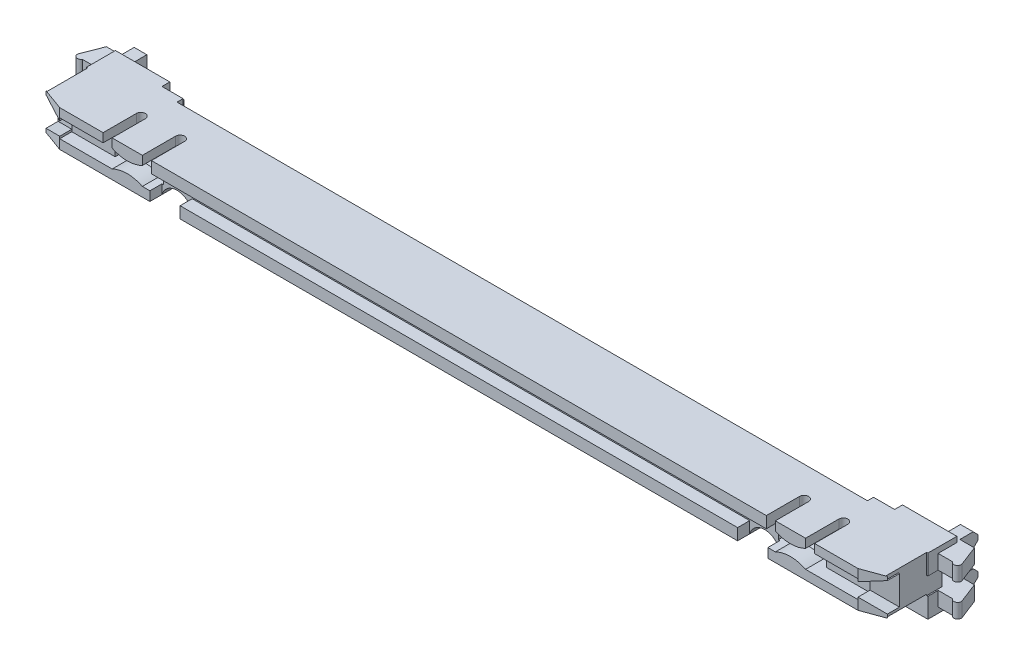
SolidWorks part; units mm, degrees
ref_plane "前视基准面" through (0, 0, 0) normal (0, 0, 1) x (1, 0, 0)
ref_plane "上视基准面" through (0, 0, 0) normal (0, 1, 0) x (1, 0, 0)
ref_plane "右视基准面" through (0, 0, 0) normal (1, 0, 0) x (0, 0, -1)
sketch "草图1" plane through (0, 0, 0) normal (0, 0, 1) x (1, 0, 0)
  line L0 (-43.2098, -1.25) -> (43.2098, -1.25)
  line L1 (-69.65, 4.75) -> (69.65, 4.75)
  line L2 (-69.65, 4.75) -> (-69.65, -4.75)
  line L3 (-69.65, -4.75) -> (-50.15, -4.75)
  line L4 (69.65, 4.75) -> (69.65, -4.75)
  line L5 (-69.65, 4.75) -> (69.65, -4.75) construction
  line L6 (-69.65, -4.75) -> (69.65, 4.75) construction
  line L7 (0, 0) -> (0, 14.6466) construction
  line L8 (-45.85, -2.8255) -> (-46.4498, -3.9371)
  line L9 (-48.65, -1.75) -> (-48.65, -2.75) construction
  line L10 (50.15, -4.75) -> (69.65, -4.75)
  line L11 (45.85, -2.8255) -> (46.4498, -3.9371)
  line L12 (-48.65, -2) -> (-48.65, -2.5) construction
  line L13 (-47.4, -2) -> (-47.4, -2.5)
  line L14 (-49.9, -2) -> (-49.9, -2.5)
  line L15 (48.65, -2) -> (48.65, -2.5) construction
  line L16 (47.4, -2) -> (47.4, -2.5)
  line L17 (49.9, -2) -> (49.9, -2.5)
  arc A0 (50.15, -4.75) -> (46.4498, -3.9371) centre (48.65, -2.75) cw
  arc A1 (-50.15, -4.75) -> (-46.4498, -3.9371) centre (-48.65, -2.75) ccw
  arc A2 (-47.4, -2) -> (-49.9, -2) centre (-48.65, -2) ccw
  arc A3 (-49.9, -2.5) -> (-47.4, -2.5) centre (-48.65, -2.5) ccw
  arc A4 (47.4, -2) -> (49.9, -2) centre (48.65, -2) cw
  arc A5 (49.9, -2.5) -> (47.4, -2.5) centre (48.65, -2.5) cw
  arc A6 (45.85, -2.8255) -> (43.2098, -1.25) centre (43.2098, -4.25) ccw
  arc A7 (-45.85, -2.8255) -> (-43.2098, -1.25) centre (-43.2098, -4.25) cw
  point P0 (0, 0)
  point P12 (-48.65, -2.25)
  point P19 (-48.65, -2.25)
  point P24 (-48.65, -0.75)
  point P25 (-48.65, -3.75)
  point P31 (48.65, -2.25)
  point P36 (45, -1.25)
  point P39 (-45, -1.25)
  dimension "D5" = 2.5
  dimension "D8" = 21
  dimension "D11" = 3
  dimension "D9" = 7.5
  dimension "D1" = 139.3
  dimension "D2" = 9.5
  dimension "D3" = 2.5
  dimension "D4" = 3
  dimension "D6" = 5.5
  dimension "D7" = 24.65
  dimension "D10" = 6
extrude "凸台-拉伸1" add sketch "草图1" along normal blind 8.5
sketch "草图3" plane through (0, 0, 8.5) normal (0, 0, 1) x (1, 0, 0)
  line L0 (69.65, -4.75) -> (69.65, 4.75) construction
  line L1 (-69.65, 4.75) -> (69.65, 4.75)
  line L2 (-69.65, 4.75) -> (-69.65, 2.85)
  line L3 (-69.65, 2.85) -> (69.65, 2.85)
  line L4 (69.65, 4.75) -> (69.65, 2.85)
  line L5 (-69.65, 4.75) -> (-69.65, -4.75) construction
  line L6 (-69.65, 0.65) -> (-51.15, 0.65)
  line L7 (-69.65, 0.65) -> (-69.65, -1.25)
  line L8 (-69.65, -1.25) -> (-51.15, -1.25)
  line L9 (69.65, 0.65) -> (69.65, -1.25)
  line L10 (-43.2098, -1.25) -> (43.2098, -1.25) construction
  line L11 (-51.15, 0.65) -> (-51.15, -1.25)
  line L12 (-46.15, 0.65) -> (-46.15, -1.25)
  line L13 (-46.15, 0.65) -> (46.15, 0.65)
  line L14 (-46.15, -1.25) -> (46.15, -1.25)
  line L15 (46.15, 0.65) -> (46.15, -1.25)
  line L16 (51.15, 0.65) -> (51.15, -1.25)
  line L17 (51.15, 0.65) -> (69.65, 0.65)
  line L18 (51.15, -1.25) -> (69.65, -1.25)
  dimension "D1" = 1.9
  dimension "D2" = 1.9
  dimension "D3" = 18.5
  dimension "D4" = 5
  dimension "D5" = 5
  dimension "D6" = 18.5
extrude "凸台-拉伸2" add sketch "草图3" along normal blind 2
sketch "草图4" plane through (0, 0, 0) normal (0, 0, -1) x (-1, 0, 0)
  line L0 (-69.65, 4.75) -> (69.65, 4.75) construction
  line L1 (0, 0) -> (0, -11.2324) construction
  line L2 (-16.325, 3.25) -> (-0.5, 3.25)
  line L3 (-33.15, 3.25) -> (-17.325, 3.25)
  line L4 (-33.15, 3.25) -> (-33.15, 0.25)
  line L5 (-50.9, 3.29) -> (-67.35, 3.29)
  line L6 (-50.9, -2) -> (-50.9, -3.25)
  line L8 (-67.35, -3.25) -> (-67.35, 3.29)
  line L9 (-50.9, 2.25) -> (-50.9, 3.29)
  line L10 (-48.9, 2.25) -> (-50.9, 2.25)
  line L11 (-50.9, -3.25) -> (-67.35, -3.25)
  line L12 (-48.9, 3.25) -> (-48.9, 2.25)
  line L13 (-34.15, 0.25) -> (-48.65, 0.25)
  line L14 (-34.15, 3.25) -> (-34.15, 0.25)
  line L15 (-34.15, 3.25) -> (-48.9, 3.25)
  line L17 (-33.15, 0.25) -> (-17.325, 0.25)
  line L18 (-17.325, 3.25) -> (-17.325, 0.25)
  line L19 (-16.325, 3.25) -> (-16.325, 0.25)
  line L20 (-16.325, 0.25) -> (-0.5, 0.25)
  line L21 (-0.5, 3.25) -> (-0.5, 0.25)
  line L22 (0.5, 3.25) -> (16.325, 3.25)
  line L23 (0.5, 3.25) -> (0.5, 0.25)
  line L24 (0.5, 0.25) -> (16.325, 0.25)
  line L25 (16.325, 3.25) -> (16.325, 0.25)
  line L26 (17.325, 3.25) -> (33.15, 3.25)
  line L27 (17.325, 3.25) -> (17.325, 0.25)
  line L28 (17.325, 0.25) -> (33.15, 0.25)
  line L29 (33.15, 3.25) -> (33.15, 0.25)
  line L32 (34.15, 3.25) -> (48.9, 3.25)
  line L33 (34.15, 3.25) -> (34.15, 0.25)
  line L34 (34.15, 0.25) -> (48.65, 0.25)
  line L35 (48.9, 3.25) -> (48.9, 2.25)
  line L37 (43.2098, -1.25) -> (-43.2098, -1.25) construction
  line L38 (69.65, 4.75) -> (69.65, -4.75) construction
  line L39 (50.9, -3.25) -> (67.35, -3.25)
  line L40 (48.9, 2.25) -> (50.9, 2.25)
  line L41 (50.9, 2.25) -> (50.9, 3.29)
  line L42 (67.35, -3.25) -> (67.35, 3.29)
  line L45 (69.65, -4.75) -> (50.15, -4.75) construction
  line L46 (50.9, -2) -> (50.9, -3.25)
  line L54 (50.9, 3.29) -> (67.35, 3.29)
  arc A0 (50.9, -2) -> (48.65, 0.25) centre (48.65, -2) ccw
  arc A2 (-48.65, 0.25) -> (-50.9, -2) centre (-48.65, -2) ccw
  dimension "D3" = 1.5
  dimension "D5" = 2
  dimension "D4" = 1.5
  dimension "D15" = 4.5
  dimension "D2" = 35.5
  dimension "D6" = 1
  dimension "D7" = 2.5
  dimension "D8" = 2.3
  dimension "D9" = 1.46
  dimension "D10" = 1.5
  dimension "D13" = 1
  dimension "D14" = 1
  dimension "D12" = 4
extrude "切除-拉伸1" cut sketch "草图4" against normal blind 1.4
ref_plane "基准面1" through (0, 3.85, 0) normal (0, 1, 0) x (1, 0, 0)
sketch "草图5" plane through (0, 3.85, 0) normal (0, 1, 0) x (1, 0, 0)
  line L0 (67.35, 0) -> (69.65, 0)
  line L1 (50.15, 0) -> (69.65, 0) construction
  line L2 (69.65, 0) -> (69.65, -0.8)
  line L3 (69.65, -8.5) -> (69.65, 0) construction
  line L4 (69.65, -0.8) -> (72.0453, -0.8)
  line L5 (73.1243, -0.2829) -> (71.85, 3)
  line L6 (71.85, 3) -> (69.45, 3)
  line L7 (69.45, 3) -> (69.45, 6)
  line L8 (69.45, 6) -> (67.35, 6)
  line L9 (67.35, 6) -> (67.35, 0)
  line L11 (0, 0) -> (0, 16.9322) construction
  line L12 (-67.35, 6) -> (-67.35, 0)
  line L13 (-69.45, 6) -> (-67.35, 6)
  line L14 (-69.45, 3) -> (-69.45, 6)
  line L15 (-71.85, 3) -> (-69.45, 3)
  line L16 (-73.1243, -0.2829) -> (-71.85, 3)
  line L17 (-69.65, -0.8) -> (-72.0453, -0.8)
  line L18 (-69.65, 0) -> (-69.65, -0.8)
  line L19 (-67.35, 0) -> (-69.65, 0)
  arc A0 (72.0453, -0.8) -> (73.1243, -0.2829) centre (72.5649, -0.5) ccw
  arc A1 (-72.0453, -0.8) -> (-73.1243, -0.2829) centre (-72.5649, -0.5) cw
  point P17 (69.65, -4.25)
  dimension "D9" = 0.6
  dimension "D1" = 6
  dimension "D2" = 0.8
  dimension "D3" = 0.3
  dimension "D4" = 2.3
  dimension "D5" = 2.1
  dimension "D6" = 3
  dimension "D7" = 4.5
  dimension "D8" = 2.9149
extrude "凸台-拉伸3" add sketch "草图5" against normal blind 2.4
mirror "镜向1" about plane through (0, 0, 0) normal (0, 1, 0) of "凸台-拉伸3"
sketch "草图6" plane through (0, 0, 0) normal (0, 0, -1) x (-1, 0, 0)
  line L1 (69.65, 4.75) -> (57.15, 4.75)
  line L2 (69.65, 4.75) -> (69.65, 3.29)
  line L3 (69.65, 3.29) -> (57.15, 3.29)
  line L4 (57.15, 4.75) -> (57.15, 3.29)
  line L5 (50.9, -3.25) -> (67.35, -3.25) construction
  line L6 (69.65, -4.75) -> (57.15, -4.75)
  line L7 (69.65, -4.75) -> (69.65, -3.25)
  line L8 (69.65, -3.25) -> (57.15, -3.25)
  line L9 (57.15, -4.75) -> (57.15, -3.25)
  line L11 (-69.65, 4.75) -> (-57.15, 4.75)
  line L12 (-69.65, 4.75) -> (-69.65, 3.29)
  line L13 (-69.65, 3.29) -> (-57.15, 3.29)
  line L14 (-57.15, 4.75) -> (-57.15, 3.29)
  line L16 (-69.65, -4.75) -> (-57.15, -4.75)
  line L17 (-69.65, -4.75) -> (-69.65, -3.25)
  line L18 (-69.65, -3.25) -> (-57.15, -3.25)
  line L19 (-57.15, -4.75) -> (-57.15, -3.25)
  line L20 (-50.9, 3.29) -> (-67.35, 3.29) construction
  line L21 (-67.35, -3.25) -> (-50.9, -3.25) construction
  line L22 (67.35, 3.29) -> (50.9, 3.29) construction
  dimension "D1" = 12.5
  dimension "D2" = 12.5
  dimension "D3" = 12.5
  dimension "D4" = 12.5
extrude "凸台-拉伸4" add sketch "草图6" along normal blind 1
sketch "草图7" plane through (0, 0, -1) normal (0, 0, -1) x (-1, 0, 0)
  line L1 (-69.65, 4.75) -> (-60.65, 4.75)
  line L2 (-69.65, 4.75) -> (-69.65, 3.29)
  line L3 (-69.65, 3.29) -> (-60.65, 3.29)
  line L4 (-60.65, 4.75) -> (-60.65, 3.29)
  line L5 (-57.15, -3.25) -> (-67.35, -3.25) construction
  line L6 (-69.65, -4.75) -> (-60.65, -4.75)
  line L7 (-69.65, -4.75) -> (-69.65, -3.25)
  line L8 (-69.65, -3.25) -> (-60.65, -3.25)
  line L9 (-60.65, -4.75) -> (-60.65, -3.25)
  line L11 (69.65, 4.75) -> (60.65, 4.75)
  line L12 (69.65, 4.75) -> (69.65, 3.29)
  line L13 (69.65, 3.29) -> (60.65, 3.29)
  line L14 (60.65, 4.75) -> (60.65, 3.29)
  line L15 (50.9, -3.25) -> (67.35, -3.25) construction
  line L16 (69.65, -4.75) -> (60.65, -4.75)
  line L17 (69.65, -4.75) -> (69.65, -3.25)
  line L18 (69.65, -3.25) -> (60.65, -3.25)
  line L19 (60.65, -4.75) -> (60.65, -3.25)
  line L20 (-67.35, 3.29) -> (-57.15, 3.29) construction
  line L21 (57.15, 3.29) -> (67.35, 3.29) construction
  dimension "D1" = 9
extrude "凸台-拉伸5" add sketch "草图7" along normal blind 1.3
chamfer "倒角1" distance 1.3 angle 70 10 edges at (69.65, 3.8, 10.5) (69.65, -0.3, 10.5) (69.65, 0.65, 9.5) (-69.65, -0.3, 10.5) (-69.65, 0.65, 9.5) (-69.65, 3.8, 10.5)
chamfer "倒角2" distance 0.8 angle 45 12 edges at (68.4, -3.85, -6) (67.35, -2.65, -6) (68.4, -1.45, -6) (68.4, 1.45, -6) (67.35, 2.65, -6) (68.4, 3.85, -6) (-68.4, -3.85, -6) (-67.35, -2.65, -6) (-68.4, -1.45, -6) (-68.4, 1.45, -6) (-67.35, 2.65, -6) (-68.4, 3.85, -6)
sketch "草图9" plane through (0, 0, 0) normal (0, 1, 0) x (1, 0, 0)
  line L0 (-60.9, 4.2) -> (-60.9, -1.4)
  line L1 (-50.9, -1.4) -> (-67.35, -1.4) construction
  line L2 (-60.9, -1.4) -> (-58.9, -1.4)
  line L3 (-58.9, -1.4) -> (-59.5771, 3.4177)
  line L4 (-60.2, 4.2) -> (-60.9, 4.2)
  line L5 (-60.2, 4.2) -> (-59.5771, 3.4177)
  line L7 (-69.65, -9.2) -> (-69.65, 2.3) construction
  line L8 (0, 0) -> (0, 15.3008) construction
  line L9 (60.2, 4.2) -> (59.5771, 3.4177)
  line L10 (60.2, 4.2) -> (60.9, 4.2)
  line L11 (58.9, -1.4) -> (59.5771, 3.4177)
  line L12 (60.9, -1.4) -> (58.9, -1.4)
  line L13 (60.9, 4.2) -> (60.9, -1.4)
  line L14 (57.15, 0) -> (-57.15, 0) construction
  dimension "D1" = 4.2
  dimension "D2" = 8.75
  dimension "D3" = 2
  dimension "D4" = 0.7
  dimension "D5" = 8
  dimension "D6" = 1
extrude "凸台-拉伸6" add sketch "草图9" along normal mid plane 3
sketch "草图10" plane through (0, 0, 8.5) normal (0, 0, 1) x (1, 0, 0)
  line L0 (-69.65, -1.25) -> (-51.15, -1.25)
  line L1 (-46.15, -1.25) -> (-43.2098, -1.25)
  line L2 (-46.15, -1.25) -> (46.15, -1.25) construction
  line L3 (-43.2098, -1.25) -> (-43.2098, -6.7744)
  line L4 (-43.2098, -6.7744) -> (-69.65, -6.7744)
  line L5 (-69.65, -6.7744) -> (-69.65, -1.25)
  line L6 (0, 0) -> (0, -9.6293) construction
  line L7 (69.65, -6.7744) -> (69.65, -1.25)
  line L8 (43.2098, -6.7744) -> (69.65, -6.7744)
  line L9 (43.2098, -1.25) -> (43.2098, -6.7744)
  line L10 (46.15, -1.25) -> (43.2098, -1.25)
  line L11 (69.65, -1.25) -> (51.15, -1.25)
  arc A0 (-51.15, -1.25) -> (-46.15, -1.25) centre (-48.65, -2) cw
  arc A1 (-43.2098, -1.25) -> (-45.85, -2.8255) centre (-43.2098, -4.25) ccw construction
  arc A2 (-47.4, -2) -> (-49.9, -2) centre (-48.65, -2) ccw construction
  arc A3 (51.15, -1.25) -> (46.15, -1.25) centre (48.65, -2) ccw
  dimension "D1" = 5.5244
extrude "切除-拉伸2" cut sketch "草图10" against normal blind 6
sketch "草图16" plane through (0, 0, 1.4) normal (0, 0, -1) x (-1, 0, 0)
  line L0 (-60.9, 1.5) -> (-60.9, -1.5) construction
  line L1 (-67.35, 3.29) -> (-60.9, 3.29)
  line L2 (-67.35, 3.29) -> (-67.35, 0.29)
  line L3 (-67.35, 0.29) -> (-60.9, 0.29)
  line L4 (-60.9, 3.29) -> (-60.9, 0.29)
  line L5 (-58.9, 1.5) -> (-58.9, -1.5) construction
  line L6 (-58.9, 0.29) -> (-50.9, 0.29)
  line L7 (-58.9, 0.29) -> (-58.9, 3.29)
  line L8 (-58.9, 3.29) -> (-50.9, 3.29)
  line L9 (-50.9, 0.29) -> (-50.9, 3.29)
  line L10 (-48.9, 1.25) -> (-47.4, 1.25)
  line L11 (-48.65, 0.25) -> (-34.15, 0.25) construction
  line L12 (-44.6052, 0.25) -> (-34.15, 0.25)
  line L13 (-34.15, 0.25) -> (-34.15, 3.25)
  line L14 (-34.15, 3.25) -> (-48.9, 3.25) construction
  line L15 (-34.15, 0.25) -> (-34.15, 3.25) construction
  line L16 (-34.15, 3.25) -> (-48.9, 3.25)
  line L17 (0, 0) -> (0, -5.9096) construction
  line L18 (34.15, 3.25) -> (48.9, 3.25)
  line L19 (34.15, 0.25) -> (34.15, 3.25)
  line L20 (44.6052, 0.25) -> (34.15, 0.25)
  line L21 (48.9, 1.25) -> (47.4, 1.25)
  line L22 (50.9, 0.29) -> (50.9, 3.29)
  line L23 (58.9, 3.29) -> (50.9, 3.29)
  line L24 (58.9, 0.29) -> (58.9, 3.29)
  line L25 (58.9, 0.29) -> (50.9, 0.29)
  line L26 (60.9, 3.29) -> (60.9, 0.29)
  line L27 (67.35, 0.29) -> (60.9, 0.29)
  line L28 (67.35, 3.29) -> (67.35, 0.29)
  line L29 (67.35, 3.29) -> (60.9, 3.29)
  line L31 (-33.15, 3.25) -> (-17.325, 3.25)
  line L32 (-33.15, 3.25) -> (-33.15, 0.25)
  line L33 (-33.15, 0.25) -> (-17.325, 0.25)
  line L34 (-17.325, 3.25) -> (-17.325, 0.25)
  line L35 (-16.325, 3.25) -> (-0.5, 3.25)
  line L36 (-16.325, 3.25) -> (-16.325, 0.25)
  line L37 (-16.325, 0.25) -> (-0.5, 0.25)
  line L38 (-0.5, 3.25) -> (-0.5, 0.25)
  line L39 (0.5, 3.25) -> (16.325, 3.25)
  line L40 (0.5, 3.25) -> (0.5, 0.25)
  line L41 (0.5, 0.25) -> (16.325, 0.25)
  line L42 (16.325, 3.25) -> (16.325, 0.25)
  line L43 (17.325, 3.25) -> (33.15, 3.25)
  line L44 (17.325, 3.25) -> (17.325, 0.25)
  line L45 (17.325, 0.25) -> (33.15, 0.25)
  line L46 (33.15, 3.25) -> (33.15, 0.25)
  arc A0 (-48.9, 3.25) -> (-48.9, 1.25) centre (-48.9, 2.25) ccw
  arc A1 (-47.4, 1.25) -> (-44.6052, 0.25) centre (-47.4, -3.1554) cw
  arc A2 (47.4, 1.25) -> (44.6052, 0.25) centre (47.4, -3.1554) ccw
  arc A3 (48.9, 3.25) -> (48.9, 1.25) centre (48.9, 2.25) cw
  dimension "D2" = 4.4054
  dimension "D3" = 1.5
  dimension "D1" = 3
extrude "切除-拉伸5" cut sketch "草图16" against normal blind 6.5 and the other way blind 7
sketch "草图18" plane through (0, 0, 7.9) normal (0, 0, -1) x (-1, 0, 0)
  line L0 (-58.9, 0.29) -> (-50.9, 0.29) construction
  line L1 (-58.9, 3.29) -> (-50.9, 3.29)
  line L2 (-58.9, 3.29) -> (-58.9, 0.29)
  line L3 (-58.9, 0.29) -> (-50.9, 0.29)
  line L4 (-50.9, 3.29) -> (-50.9, 0.29)
  line L5 (-58.9, 0.29) -> (-50.9, 0.29) construction
  line L7 (50.9, 3.29) -> (58.9, 3.29)
  line L8 (50.9, 3.29) -> (50.9, 0.29)
  line L9 (50.9, 0.29) -> (58.9, 0.29)
  line L10 (58.9, 3.29) -> (58.9, 0.29)
extrude "切除-拉伸6" cut sketch "草图18" against normal through all
sketch "草图19" plane through (0, 0, 8.5) normal (0, 0, 1) x (1, 0, 0)
  line L0 (-66.0783, 2.85) -> (-58.9, 2.85) construction
  line L1 (-58.9, 3.29) -> (-66.0783, 3.29)
  line L2 (-58.9, 3.29) -> (-58.9, 2.85)
  line L3 (-58.9, 2.85) -> (-66.0783, 2.85)
  line L4 (-66.0783, 3.29) -> (-66.0783, 2.85)
  line L6 (-66.0783, 4.75) -> (-66.0783, 2.85) construction
  line L8 (-58.9, 0.29) -> (-66.0783, 0.29)
  line L9 (-58.9, 0.29) -> (-58.9, 0.65)
  line L10 (-58.9, 0.65) -> (-66.0783, 0.65)
  line L11 (-66.0783, 0.29) -> (-66.0783, 0.65)
  line L12 (58.9, 3.29) -> (66.0783, 3.29)
  line L13 (58.9, 3.29) -> (58.9, 2.85)
  line L14 (58.9, 2.85) -> (66.0783, 2.85)
  line L15 (66.0783, 3.29) -> (66.0783, 2.85)
  line L16 (58.9, 0.29) -> (66.0783, 0.29)
  line L17 (58.9, 0.29) -> (58.9, 0.65)
  line L18 (58.9, 0.65) -> (66.0783, 0.65)
  line L19 (66.0783, 0.29) -> (66.0783, 0.65)
extrude "切除-拉伸7" cut sketch "草图19" along normal blind 7
sketch "草图20" plane through (0, 0, 10.5) normal (0, 0, 1) x (1, 0, 0)
  line L0 (50.9, 3.29) -> (66.0783, 3.29) construction
  line L1 (66.0783, 0.29) -> (51.15, 0.29) construction
  line L2 (50.9, 2.85) -> (50.9, 3.29) construction
  line L3 (52.4, 3.29) -> (57.4, 3.29)
  line L4 (57.4, 0.29) -> (52.4, 0.29)
  line L5 (0, 0) -> (0, -9.7106) construction
  line L6 (-57.4, 0.29) -> (-52.4, 0.29)
  line L7 (-52.4, 3.29) -> (-57.4, 3.29)
  arc A0 (52.4, 3.29) -> (57.4, 3.29) centre (54.9, 8.29) ccw
  arc A1 (52.4, 0.29) -> (57.4, 0.29) centre (54.9, -4.71) cw
  arc A2 (-52.4, 0.29) -> (-57.4, 0.29) centre (-54.9, -4.71) ccw
  arc A3 (-52.4, 3.29) -> (-57.4, 3.29) centre (-54.9, 8.29) cw
  point P8 (50.9, 3.07)
  dimension "D2" = 5
  dimension "D1" = 5
  dimension "D3" = 5
  dimension "D4" = 5
  dimension "D5" = 1.5
  dimension "D6" = 1.5
extrude "凸台-拉伸7" add sketch "草图20" against normal blind 3
sketch "草图21" plane through (0, 4.75, 0) normal (0, 1, 0) x (1, 0, 0)
  line L0 (-58.15, -10.5) -> (-58.15, -5) construction
  line L1 (-66.0783, -10.5) -> (-51.15, -10.5) construction
  line L2 (-58.9, -10.5) -> (-58.9, -5)
  line L3 (-57.4, -10.5) -> (-57.4, -5)
  line L4 (-51.65, -10.5) -> (-51.65, -5) construction
  line L5 (-52.4, -10.5) -> (-52.4, -5)
  line L6 (-50.9, -10.5) -> (-50.9, -5)
  line L7 (-50.9, -10.5) -> (-50.9, -8.5) construction
  line L9 (-57.4, -7.5) -> (-57.4, -10.5) construction
  line L10 (0, 0) -> (0, -27.0986) construction
  line L11 (58.15, -10.5) -> (58.15, -5) construction
  line L12 (58.9, -10.5) -> (58.9, -5)
  line L13 (57.4, -10.5) -> (57.4, -5)
  line L14 (51.65, -10.5) -> (51.65, -5) construction
  line L15 (52.4, -10.5) -> (52.4, -5)
  line L16 (50.9, -10.5) -> (50.9, -5)
  arc A0 (-58.9, -10.5) -> (-57.4, -10.5) centre (-58.15, -10.5) ccw
  arc A1 (-57.4, -5) -> (-58.9, -5) centre (-58.15, -5) ccw
  arc A2 (-52.4, -10.5) -> (-50.9, -10.5) centre (-51.65, -10.5) ccw
  arc A3 (-50.9, -5) -> (-52.4, -5) centre (-51.65, -5) ccw
  arc A4 (58.9, -10.5) -> (57.4, -10.5) centre (58.15, -10.5) cw
  arc A5 (57.4, -5) -> (58.9, -5) centre (58.15, -5) cw
  arc A6 (52.4, -10.5) -> (50.9, -10.5) centre (51.65, -10.5) cw
  arc A7 (50.9, -5) -> (52.4, -5) centre (51.65, -5) cw
  point P4 (-58.15, -7.75)
  point P9 (-51.65, -7.75)
  point P25 (58.15, -7.75)
  point P32 (51.65, -7.75)
  dimension "D1" = 1.5
  dimension "D2" = 5.5
  dimension "D3" = 1.5
  dimension "D4" = 5.5
extrude "切除-拉伸8" cut sketch "草图21" against normal blind 3
sketch "草图22" plane through (69.65, 0, 0) normal (1, 0, 0) x (0, 0, -1)
  line L0 (0, 1.45) -> (0, -1.45)
  line L1 (0, -1.45) -> (-2.5, -1.45)
  line L2 (-2.5, -4.75) -> (-2.5, -1.25) construction
  line L3 (-2.5, -1.45) -> (-2.5, -1.25)
  line L4 (-2.5, -1.25) -> (-9.2, -1.25)
  line L5 (-9.2, -1.25) -> (-9.2, -0.65)
  line L6 (-9.2, -0.65) -> (-7.2, -0.65)
  line L7 (-7.2, -0.65) -> (-7.2, 4.15)
  line L8 (-7.2, 4.15) -> (-9.2, 4.15)
  line L9 (-9.2, 4.15) -> (-9.2, 4.75)
  line L10 (-9.2, 4.75) -> (-2.5, 4.75)
  line L12 (0, 1.45) -> (-2.5, 1.45)
  line L13 (-2.5, 1.45) -> (-2.5, 4.75)
  line L16 (-9.2, 4.75) -> (2.3, 4.75) construction
extrude "切除-拉伸9" cut sketch "草图22" against normal blind 0.2
mirror "镜向2" about plane through (0, 0, 0) normal (1, 0, 0) of "切除-拉伸9"
sketch "草图23" plane through (0, 0, 2.5) normal (0, 0, 1) x (1, 0, 0)
  line L0 (-63.65, -2.25) -> (-54.6743, -2.25) construction
  line L2 (-69.65, -1.45) -> (-69.65, -4.75) construction
  line L4 (-51.15, -1.25) -> (-69.45, -1.25) construction
  text T0 "VERO" font "黑体" height 1.5
  dimension "D1" = 1
  dimension "D2" = 6
extrude "切除-拉伸10" [suppressed] cut sketch "草图23" against normal blind 0.2
